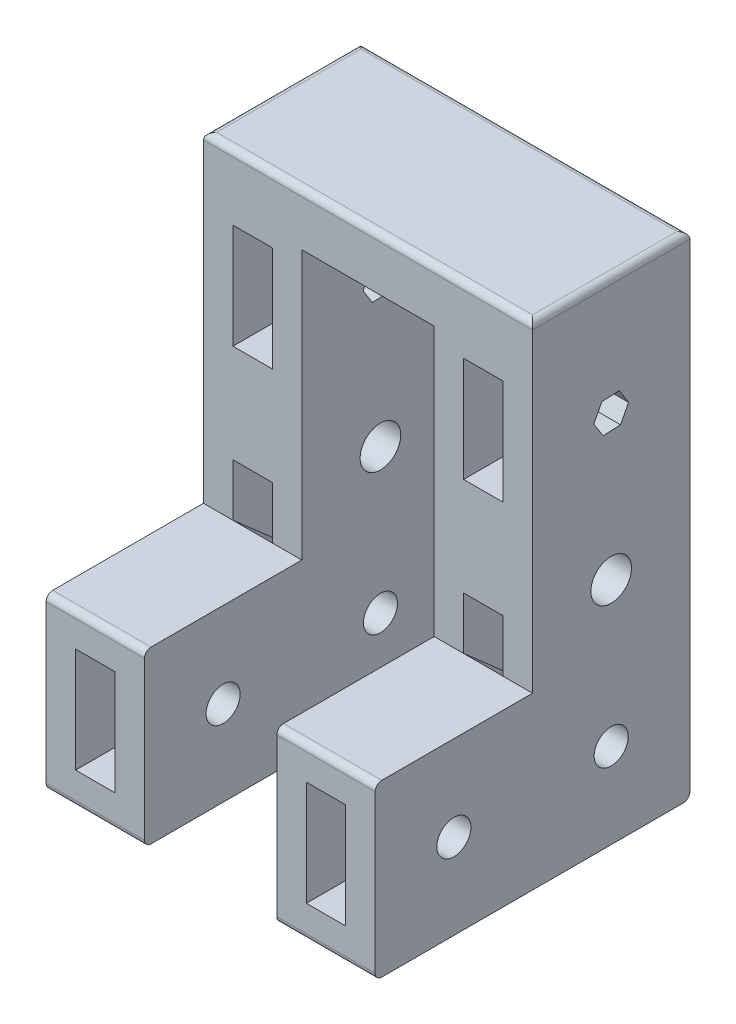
SolidWorks part; units mm, degrees
ref_plane "正面" through (0, 0, 0) normal (1, 0, 0) x (0, 1, 0)
ref_plane "平面" through (0, 0, 0) normal (0, 0, 1) x (0, 1, 0)
ref_plane "右側面" through (0, 0, 0) normal (0, 1, 0) x (-1, 0, 0)
sketch "ｽｹｯﾁ1" plane through (0, 0, 0) normal (1, 0, 0) x (0, 1, 0)
  line L0 (-31.7958, 21.3486) -> (-31.7958, -26.6514)
  line L1 (-31.7958, -26.6514) -> (43.2042, -26.6514)
  line L2 (43.2042, -26.6514) -> (43.2042, -2.6514)
  line L3 (43.2042, -2.6514) -> (-5.7958, -2.6514)
  line L4 (-5.7958, -2.6514) -> (-5.7958, 21.3486)
  line L5 (-5.7958, 21.3486) -> (-31.7958, 21.3486)
  dimension "D1" = 75
  dimension "D2" = 26
  dimension "D3" = 48
  dimension "D4" = 24
extrude "ﾎﾞｽ - 押し出し1" add sketch "ｽｹｯﾁ1" along normal mid plane 50.2
sketch "ｽｹｯﾁ2" plane through (25.1, 0, 0) normal (1, 0, 0) x (0, 1, 0)
  line L0 (-5.7958, 21.3486) -> (-31.7958, 21.3486) construction
  line L1 (43.2042, -2.6514) -> (-5.7958, -2.6514) construction
  line L2 (-31.7958, 21.3486) -> (-31.7958, -26.6514) construction
  line L4 (27.5582, -15.881) -> (27.4461, -13.2276)
  line L5 (27.4461, -13.2276) -> (25.0921, -11.998)
  line L6 (25.0921, -11.998) -> (22.8502, -13.4218)
  line L7 (22.8502, -13.4218) -> (22.9624, -16.0753)
  line L8 (22.9624, -16.0753) -> (25.3164, -17.3049)
  line L9 (25.3164, -17.3049) -> (27.5582, -15.881)
  circle A0 centre (-18.7958, 9.3486) radius 2.6
  circle A1 centre (-18.7958, -14.6514) radius 2.6
  circle A2 centre (3.2042, -14.6514) radius 3.1
  circle A4 centre (25.2042, -14.6514) radius 2.3 construction
  dimension "D9" = 5.2
  dimension "D10" = 5.2
  dimension "D11" = 6.2
  dimension "D12" = 57
  dimension "D1" = 12
  dimension "D2" = 36
  dimension "D3" = 12
  dimension "D4" = 4.6
  dimension "D5" = 13
  dimension "D6" = 13
  dimension "D7" = 35
  dimension "D8" = 12
extrude "ｶｯﾄ - 押し出し1" cut sketch "ｽｹｯﾁ2" against normal through all
sketch "ｽｹｯﾁ3" plane through (0, -31.7958, 0) normal (0, -1, 0) x (1, 0, 0)
  line L0 (25.1, 21.3486) -> (-25.1, 21.3486) construction
  line L1 (-10.1, 21.3486) -> (10.1, 21.3486)
  line L2 (-10.1, 21.3486) -> (-10.1, -26.6514)
  line L3 (-10.1, -26.6514) -> (10.1, -26.6514)
  line L4 (10.1, 21.3486) -> (10.1, -26.6514)
  line L5 (25.1, -26.6514) -> (-25.1, -26.6514) construction
  dimension "D1" = 20.2
  dimension "D2" = 10.1
extrude "ｶｯﾄ - 押し出し2" cut sketch "ｽｹｯﾁ3" against normal blind 67
sketch "ｽｹｯﾁ4" plane through (0, 0, -2.6514) normal (0, 0, 1) x (1, 0, 0)
  line L0 (-10.1, -5.7958) -> (-25.1, -5.7958) construction
  line L1 (-20.6, 33.2042) -> (-14.6, 33.2042)
  line L2 (-20.6, 33.2042) -> (-20.6, 17.2042)
  line L3 (-20.6, 17.2042) -> (-14.6, 17.2042)
  line L4 (-14.6, 33.2042) -> (-14.6, 17.2042)
  line L5 (-20.6, 33.2042) -> (-14.6, 17.2042) construction
  line L6 (-20.6, 17.2042) -> (-14.6, 33.2042) construction
  line L7 (14.6, 33.2042) -> (20.6, 33.2042)
  line L8 (14.6, 33.2042) -> (14.6, 17.2042)
  line L9 (14.6, 17.2042) -> (20.6, 17.2042)
  line L10 (20.6, 33.2042) -> (20.6, 17.2042)
  line L11 (14.6, 33.2042) -> (20.6, 17.2042) construction
  line L12 (14.6, 17.2042) -> (20.6, 33.2042) construction
  line L13 (-25.1, -5.7958) -> (-20.1, -5.7958)
  line L22 (25.1, 43.2042) -> (25.1, -5.7958) construction
  line L23 (-25.1, 43.2042) -> (-25.1, -5.7958) construction
  line L25 (25.1, 43.2042) -> (-25.1, 43.2042) construction
  point P0 (-17.6, 25.2042)
  point P5 (17.6, 25.2042)
  dimension "D1" = 6
  dimension "D2" = 16
  dimension "D3" = 6
  dimension "D4" = 16
  dimension "D5" = 18
  dimension "D6" = 18
  dimension "D9" = 4.5
  dimension "D12" = 4.5
extrude "ｶｯﾄ - 押し出し3" cut sketch "ｽｹｯﾁ4" against normal through all contours L2 L1 L4 L3 | L8 L7 L10 L9
sketch "ｽｹｯﾁ8" plane through (0, 0, -26.6514) normal (0, 0, -1) x (1, 0, 0)
  line L0 (-10.1, 31.7958) -> (-25.1, 31.7958) construction
  line L1 (-20.6, 26.7958) -> (-14.6, 26.7958)
  line L2 (-20.6, 26.7958) -> (-20.6, 10.7958)
  line L3 (-20.6, 10.7958) -> (-14.6, 10.7958)
  line L4 (-14.6, 26.7958) -> (-14.6, 10.7958)
  line L5 (-20.6, 26.7958) -> (-14.6, 10.7958) construction
  line L6 (-20.6, 10.7958) -> (-14.6, 26.7958) construction
  line L7 (-25.1, 31.7958) -> (-25.1, -43.2042) construction
  point P0 (-17.6, 18.7958)
  dimension "D1" = 13
  dimension "D2" = 6
  dimension "D3" = 16
  dimension "D4" = 4.5
sketch "ｽｹｯﾁ9" plane through (0, 0, -2.6514) normal (0, 0, 1) x (1, 0, 0)
  line L0 (-10.1, -5.7958) -> (-25.1, -5.7958) construction
  line L1 (-20.6, -5.7958) -> (-14.6, -5.7958)
  line L2 (-20.6, -5.7958) -> (-20.6, 2.2042)
  line L3 (-20.6, 2.2042) -> (-14.6, 2.2042)
  line L4 (-14.6, -5.7958) -> (-14.6, 2.2042)
  line L5 (-25.1, 43.2042) -> (-25.1, -5.7958) construction
  dimension "D1" = 6
  dimension "D2" = 4.5
  dimension "D3" = 8
loft "ｶｯﾄ - ﾛﾌﾄ1" cut profiles "ｽｹｯﾁ9", "ｽｹｯﾁ8"
sketch "ｽｹｯﾁ10" plane through (0, 0, -2.6514) normal (0, 0, 1) x (1, 0, 0)
  line L0 (25.1, -5.7958) -> (10.1, -5.7958) construction
  line L1 (14.6, -5.7958) -> (20.6, -5.7958)
  line L2 (14.6, -5.7958) -> (14.6, 2.2042)
  line L3 (14.6, 2.2042) -> (20.6, 2.2042)
  line L4 (20.6, -5.7958) -> (20.6, 2.2042)
  line L5 (10.1, 35.2042) -> (10.1, -5.7958) construction
  dimension "D1" = 6
  dimension "D2" = 8
  dimension "D3" = 4.5
sketch "ｽｹｯﾁ11" plane through (0, 0, -26.6514) normal (0, 0, -1) x (1, 0, 0)
  line L0 (25.1, 31.7958) -> (10.1, 31.7958) construction
  line L1 (14.6, 26.7958) -> (20.6, 26.7958)
  line L2 (14.6, 26.7958) -> (14.6, 10.7958)
  line L3 (14.6, 10.7958) -> (20.6, 10.7958)
  line L4 (20.6, 26.7958) -> (20.6, 10.7958)
  line L5 (14.6, 26.7958) -> (20.6, 10.7958) construction
  line L6 (14.6, 10.7958) -> (20.6, 26.7958) construction
  line L7 (10.1, -35.2042) -> (10.1, 31.7958) construction
  point P0 (17.6, 18.7958)
  dimension "D1" = 13
  dimension "D2" = 6
  dimension "D3" = 4.5
  dimension "D4" = 16
loft "ｶｯﾄ - ﾛﾌﾄ2" cut profiles "ｽｹｯﾁ11", "ｽｹｯﾁ10"
sketch "ｽｹｯﾁ12" plane through (0, 0, -26.6514) normal (0, 0, -1) x (1, 0, 0)
  line L0 (-14.6, 10.7958) -> (-14.6, 26.7958) construction
  line L1 (-20.6, 26.7958) -> (-14.6, 26.7958)
  line L2 (-20.6, 26.7958) -> (-20.6, 10.7958)
  line L3 (-20.6, 10.7958) -> (-14.6, 10.7958)
  line L4 (-14.6, 26.7958) -> (-14.6, 10.7958)
  line L5 (-20.6, 26.7958) -> (-14.6, 10.7958) construction
  line L6 (-20.6, 10.7958) -> (-14.6, 26.7958) construction
  line L7 (20.6, 10.7958) -> (20.6, 26.7958) construction
  line L8 (14.6, 26.7958) -> (20.6, 26.7958)
  line L9 (14.6, 26.7958) -> (14.6, 10.7958)
  line L10 (14.6, 10.7958) -> (20.6, 10.7958)
  line L11 (20.6, 26.7958) -> (20.6, 10.7958)
  line L12 (14.6, 26.7958) -> (20.6, 10.7958) construction
  line L13 (14.6, 10.7958) -> (20.6, 26.7958) construction
  line L14 (25.1, 31.7958) -> (10.1, 31.7958) construction
  line L16 (-10.1, 31.7958) -> (-25.1, 31.7958) construction
  point P0 (-17.6, 18.7958)
  point P7 (17.6, 18.7958)
  dimension "D1" = 6
  dimension "D2" = 16
  dimension "D3" = 16
  dimension "D4" = 6
  dimension "D5" = 13
  dimension "D6" = 13
extrude "ｶｯﾄ - 押し出し4" cut sketch "ｽｹｯﾁ12" against normal through all
fillet "ﾌｨﾚｯﾄ1" radius 1 10 edges at (0, 43.2042, -26.6514) (25.1, 43.2042, -14.6514) (0, 43.2042, -2.6514) (-25.1, 43.2042, -14.6514) (-17.6, -31.7958, -26.6514) (-17.6, -31.7958, 21.3486) (-17.6, -5.7958, 21.3486) (17.6, -5.7958, 21.3486) (17.6, -31.7958, 21.3486) (17.6, -31.7958, -26.6514)
